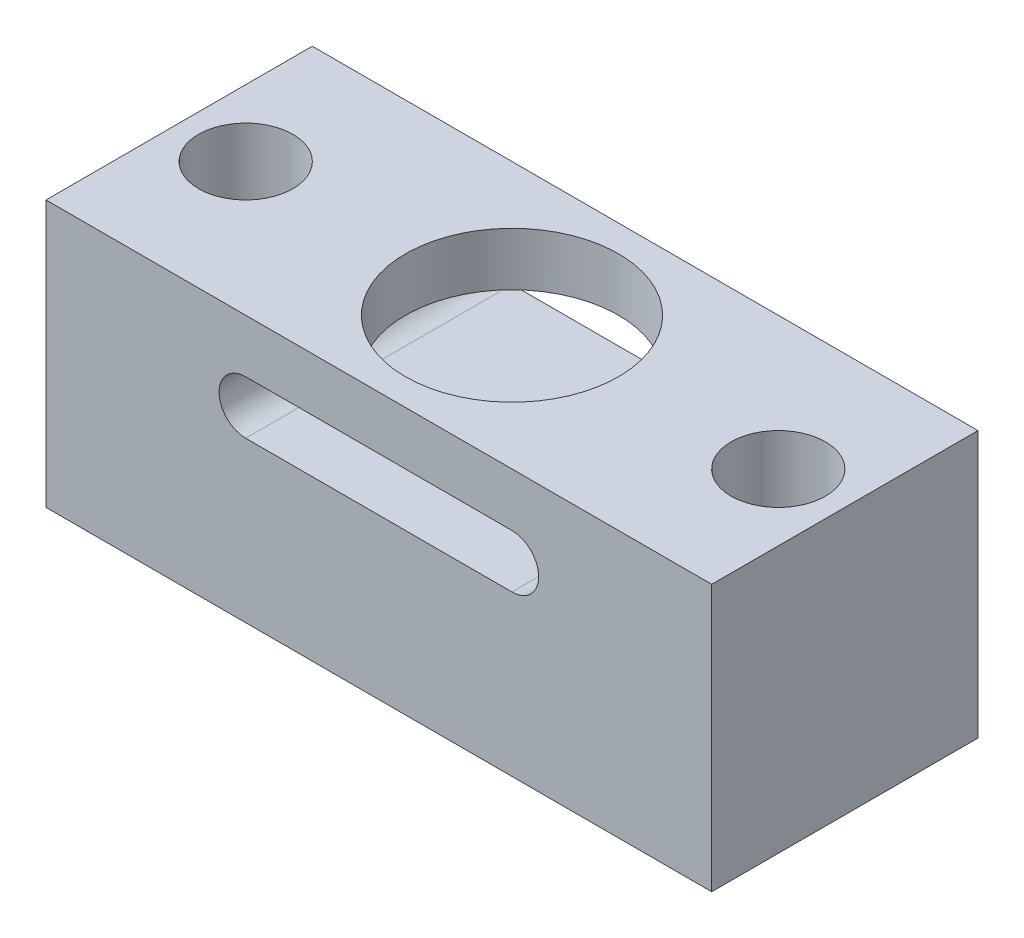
SolidWorks part; units mm, degrees
ref_plane "Front Plane" through (0, 0, 0) normal (0, 0, 1) x (1, 0, 0)
ref_plane "Top Plane" through (0, 0, 0) normal (0, 1, 0) x (1, 0, 0)
ref_plane "Right Plane" through (0, 0, 0) normal (1, 0, 0) x (0, 0, -1)
sketch "Sketch1" plane through (0, 0, 0) normal (0, 1, 0) x (1, 0, 0)
  line L1 (-35.3198, 26.9922) -> (-9.9198, 26.9922)
  line L2 (-35.3198, 26.9922) -> (-35.3198, 14.2922)
  line L3 (-35.3198, 14.2922) -> (-9.9198, 14.2922)
  line L4 (-9.9198, 26.9922) -> (-9.9198, 14.2922)
  dimension "D1" = 12.7
  dimension "D2" = 25.4
extrude "Boss-Extrude1" add sketch "Sketch1" along normal blind 12.7
sketch "Sketch6" plane through (-35.3198, 0, 0) normal (-1, 0, 0) x (0, 0, 1)
  line L1 (-26.9922, 12.7) -> (-14.2922, 12.7)
  line L2 (-26.9922, 12.7) -> (-26.9922, 0)
  line L3 (-26.9922, 0) -> (-14.2922, 0)
  line L4 (-14.2922, 12.7) -> (-14.2922, 0)
extrude "Boss-Extrude2" add sketch "Sketch6" along normal blind 6.35
sketch "Sketch7" plane through (0, 12.7, 0) normal (0, 1, 0) x (1, 0, 0)
  line L0 (-9.9198, 26.9922) -> (-41.6698, 26.9922) construction
  line L1 (-9.9198, 14.2922) -> (-9.9198, 26.9922) construction
  circle A0 centre (-25.7948, 20.6422) radius 5.08
  dimension "D1" = 6.35
  dimension "D2" = 15.875
extrude "Cut-Extrude1" cut sketch "Sketch7" against normal blind 5.08 contours A0
hole_wizard "#16 (0.177) Diameter Hole1" positions "Sketch8" profile "Sketch9" hole size "#16" standard "ANSI Inch"
sketch "Sketch8" plane through (0, 12.7, 0) normal (0, 1, 0) x (1, 0, 0)
  line L0 (-9.9198, 26.9922) -> (-41.6698, 26.9922) construction
  line L1 (-41.6698, 14.2922) -> (-41.6698, 26.9922) construction
  point P0 (-38.4948, 20.6422)
  point P2 (-13.0948, 20.6422)
  dimension "D1" = 6.35
  dimension "D2" = 6.35
  dimension "D3" = 25.4
  dimension "D4" = 3.175
sketch "Sketch9" plane through (-38.4948, 12.7, -20.6422) normal (1, 0, 0) x (0, 0, 1)
  line L0 (0, 0) -> (0, 12.7)
  line L1 (0, 12.7) -> (2.2479, 12.7)
  line L2 (2.2479, 12.7) -> (2.2479, 0)
  line L5 (2.2479, 0) -> (0, 0)
  line L11 (0, -6.35) -> (0, 107.95) construction
  dimension "Thru Hole Dia." = 4.4958
  dimension "Thru Hole Depth" = 12.7
sketch "Sketch10" plane through (0, 0, -14.2922) normal (0, 0, 1) x (1, 0, 0)
  line L0 (-32.1448, 8.89) -> (-19.4448, 8.89) construction
  line L1 (-41.6698, 12.7) -> (-9.9198, 12.7) construction
  line L2 (-32.1448, 10.16) -> (-19.4448, 10.16)
  line L3 (-32.1448, 7.62) -> (-19.4448, 7.62)
  line L4 (-41.6698, 0) -> (-41.6698, 12.7) construction
  arc A0 (-32.1448, 10.16) -> (-32.1448, 7.62) centre (-32.1448, 8.89) ccw
  arc A1 (-19.4448, 7.62) -> (-19.4448, 10.16) centre (-19.4448, 8.89) ccw
  point P4 (-25.7948, 8.89)
  dimension "D1" = 3.81
  dimension "D2" = 15.875
extrude "Cut-Extrude2" cut sketch "Sketch10" against normal through all contours L2 A1 L3 A0
